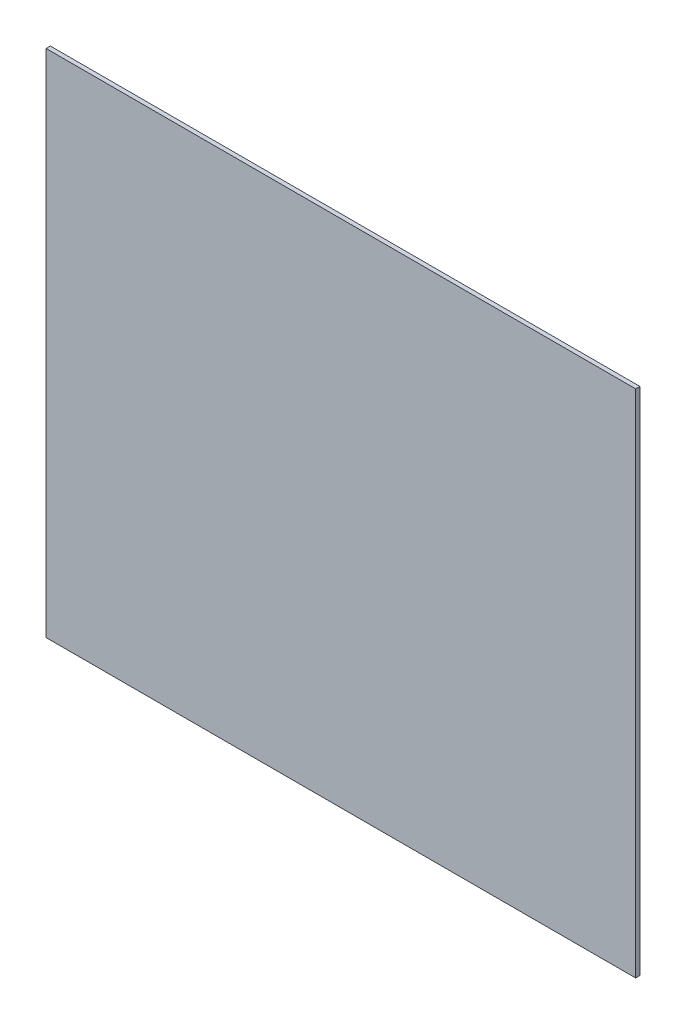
SolidWorks part; units mm, degrees
ref_plane "FRONT" through (0, 0, 0) normal (0, 0, 1) x (1, 0, 0)
ref_plane "TOP" through (0, 0, 0) normal (0, 1, 0) x (1, 0, 0)
ref_plane "RIGHT" through (0, 0, 0) normal (1, 0, 0) x (0, 0, -1)
sketch "Sketch1" plane through (0, 0, 0) normal (0, 0, 1) x (1, 0, 0)
  line L1 (-330.2, 285.75) -> (330.2, 285.75)
  line L2 (-330.2, 285.75) -> (-330.2, -285.75)
  line L3 (-330.2, -285.75) -> (330.2, -285.75)
  line L4 (330.2, 285.75) -> (330.2, -285.75)
  line L5 (-330.2, 285.75) -> (330.2, -285.75) construction
  line L6 (-330.2, -285.75) -> (330.2, 285.75) construction
  point P0 (0, 0)
  dimension "D1" = 660.4
  dimension "D2" = 571.5
extrude "Boss-Extrude1" add sketch "Sketch1" along normal blind 4.7625
